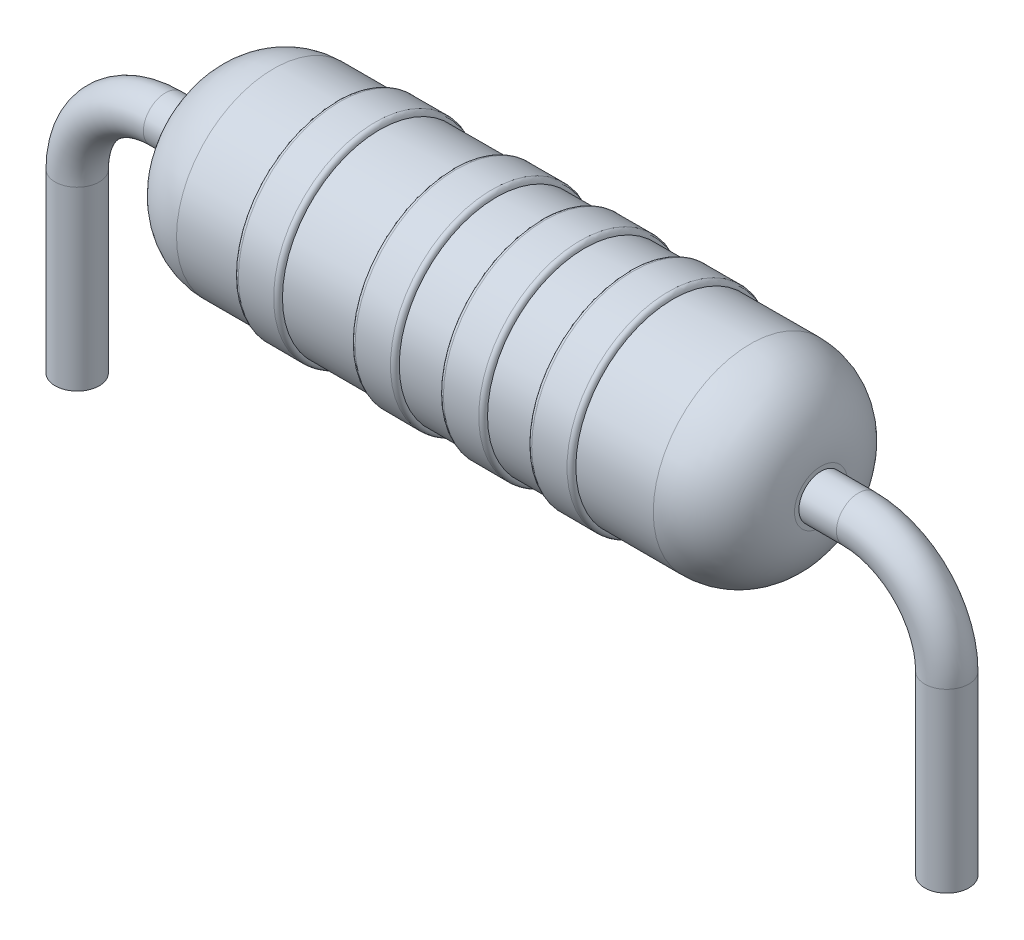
SolidWorks part; units mm, degrees
ref_plane "Face" through (0, 0, 0) normal (0, 0, 1) x (1, 0, 0)
ref_plane "Dessus" through (0, 0, 0) normal (0, 1, 0) x (1, 0, 0)
ref_plane "Droite" through (0, 0, 0) normal (1, 0, 0) x (0, 0, -1)
sketch "Esquisse1" plane through (0, 0, 0) normal (0, 0, 1) x (1, 0, 0)
  line L0 (-54.2687, 0) -> (62.1733, 0) construction
  line L1 (-48.4922, 1.1) -> (45.7559, 1.1) construction
  line L2 (-3.5, -1.6411) -> (-3.5, 4.3175) construction
  line L3 (0, -1.0268) -> (0, 4.1947) construction
  line L4 (3.5, 3.6009) -> (3.5, -1.9687) construction
  line L5 (-3.5, 0) -> (-3.5, 0.3)
  line L6 (-2.7, 1.1) -> (2.7, 1.1)
  line L7 (3.5, 0.3) -> (3.5, 0)
  line L8 (3.5, 0) -> (-3.5, 0)
  arc A0 (-2.7, 1.1) -> (-3.5, 0.3) centre (-2.7, 0.3) ccw
  arc A1 (3.5, 0.3) -> (2.7, 1.1) centre (2.7, 0.3) ccw
revolve "Base-Révolution" add sketch "Esquisse1" angle 360 about L0
sketch "Esquisse2" plane through (0, 0, 0) normal (0, 0, 1) x (1, 0, 0)
  line L0 (-3.3896, 1.15) -> (3.161, 1.15) construction
  line L1 (-2, 1.3889) -> (-2, -0.1179) construction
  line L2 (-1.5, 1.4925) -> (-1.5, -0.2136) construction
  line L3 (4.3262, 0) -> (-3.8651, 0) construction
  line L4 (1.323, 0) -> (1.823, 0)
  line L5 (0.323, 0) -> (0.823, 0)
  line L6 (-0.677, 1.15) -> (-0.677, 0)
  line L7 (0.323, 1.15) -> (0.323, 0)
  line L8 (1.323, 1.15) -> (1.323, 0)
  line L9 (-0.177, 1.15) -> (-0.177, 0)
  line L10 (0.823, 1.15) -> (0.823, 0)
  line L11 (1.823, 1.15) -> (1.823, 0)
  line L12 (-0.677, 0) -> (-0.177, 0)
  line L13 (-0.677, 1.15) -> (-0.177, 1.15)
  line L14 (0.323, 1.15) -> (0.823, 1.15)
  line L15 (1.323, 1.15) -> (1.823, 1.15)
  line L16 (-2, 1.15) -> (-1.5, 1.15)
  line L17 (-1.5, 1.15) -> (-1.5, 0)
  line L18 (-1.5, 0) -> (-2, 0)
  line L19 (-2, 0) -> (-2, 1.15)
revolve "Boss.-Révol.1" add sketch "Esquisse2" angle 360 about L3
fillet "Congé1" radius 0.05 8 edges at (-0.177, 0, -1.15) (-0.677, 0, -1.15) (0.823, 0, -1.15) (0.323, 0, -1.15) (1.823, 0, -1.15) (1.323, 0, -1.15) (-1.5, 0, -1.15) (-2, 0, -1.15)
sketch "Esquisse3" plane through (-3.5, 0, 0) normal (-1, 0, 0) x (0, 0, 1)
  circle A0 centre (0, 0) radius 0.25
sketch "Esquisse4" plane through (0, 0, 0) normal (0, 0, 1) x (1, 0, 0)
  line L0 (-3.1075, 0) -> (-5.8186, 0) construction
  line L1 (0, -2.524) -> (0, 3.2043) construction
  line L2 (-5.9326, -3) -> (3.6667, -3) construction
  line L3 (-4.925, 1.6795) -> (-4.925, -3.4934) construction
  line L4 (-3.5, 0) -> (-3.925, 0)
  line L5 (-4.925, -3) -> (-4.925, -1)
  arc A0 (-3.925, 0) -> (-4.925, -1) centre (-3.925, -1) ccw
  dimension "D3" = 1
  dimension "D1" = 3
  dimension "D2" = 4.925
sweep "Balayage1" add profiles "Esquisse3" path "Esquisse4"
ref_plane "Plan1" through (0, 0, 0) normal (1, 0, 0) x (0, 0, -1)
mirror "Symétrie1" about plane through (0, 0, 0) normal (1, 0, 0) of "Balayage1"
